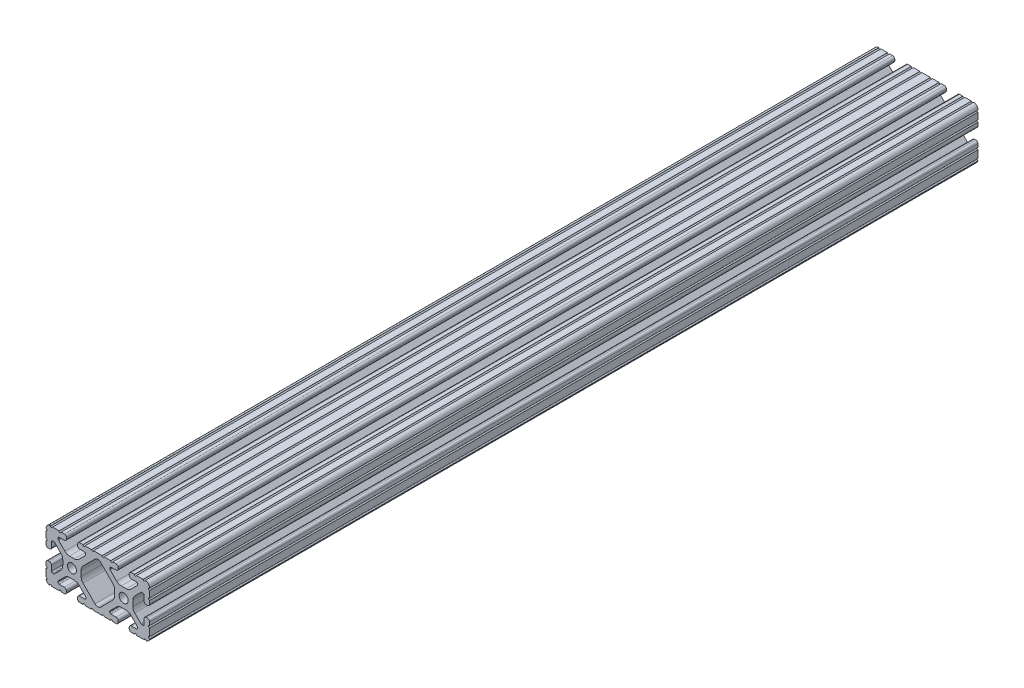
SolidWorks part; units mm, degrees
ref_plane "Front" through (0, 0, 0) normal (0, 0, 1) x (1, 0, 0)
ref_plane "Top" through (0, 0, 0) normal (0, 1, 0) x (1, 0, 0)
ref_plane "Right" through (0, 0, 0) normal (1, 0, 0) x (0, 0, -1)
sketch "Sketch1" plane through (0, 0, 0) normal (0, 0, 1) x (1, 0, 0)
  line L2 (30.3513, 26.5282) -> (39.1767, 35.3536)
  line L3 (40.5679, 38.7122) -> (40.5679, 42.8592)
  line L4 (39.1767, 46.2178) -> (30.3513, 55.0433)
  line L5 (26.1972, 55.0433) -> (17.3719, 46.2178)
  line L6 (15.9807, 42.8592) -> (15.9807, 38.7122)
  line L7 (17.3719, 35.3536) -> (26.1972, 26.5282)
  line L8 (37.19, 54.3201) -> (37.19, 54.8827)
  line L9 (38.079, 55.7717) -> (41.6855, 55.7717)
  line L10 (43.2603, 57.3465) -> (43.2603, 58.2825)
  line L11 (41.707, 59.8357) -> (39.2718, 59.8357)
  line L12 (37.7478, 59.8357) -> (32.9194, 59.8357)
  line L13 (31.3954, 59.8357) -> (25.1532, 59.8357)
  line L14 (23.6292, 59.8357) -> (18.8007, 59.8357)
  line L15 (17.2767, 59.8357) -> (14.8415, 59.8357)
  line L16 (13.2883, 58.2825) -> (13.2883, 57.3465)
  line L17 (14.8631, 55.7717) -> (18.4695, 55.7717)
  line L18 (19.3585, 54.8827) -> (19.3585, 54.3201)
  line L19 (19.0981, 53.6915) -> (14.4218, 49.0151)
  line L20 (11.0632, 47.6239) -> (7.3854, 47.6239)
  line L21 (4.0268, 49.0151) -> (-0.6496, 53.6915)
  line L22 (-0.91, 54.3201) -> (-0.91, 54.8827)
  line L23 (-0.021, 55.7717) -> (3.5855, 55.7717)
  line L24 (5.1603, 57.3465) -> (5.1603, 58.2663)
  line L25 (3.7154, 59.8357) -> (1.3285, 59.8357)
  line L26 (-0.1955, 59.8357) -> (-5.022, 59.8357)
  line L27 (-9.8257, 55.1609) -> (-9.8257, 50.3354)
  line L28 (-9.8257, 48.8114) -> (-9.8257, 46.4245)
  line L29 (-8.2509, 44.8497) -> (-7.3365, 44.8497)
  line L30 (-5.7617, 46.4245) -> (-5.7617, 50.1837)
  line L31 (-4.8727, 51.0727) -> (-4.1464, 51.0727)
  line L32 (-3.5178, 50.8123) -> (1.0767, 46.2178)
  line L33 (2.4679, 42.8592) -> (2.4679, 38.7122)
  line L34 (1.0767, 35.3536) -> (-3.5178, 30.7591)
  line L35 (-4.1464, 30.4987) -> (-4.8727, 30.4987)
  line L36 (-5.7617, 31.3877) -> (-5.7617, 35.1469)
  line L37 (-7.3365, 36.7217) -> (-8.2509, 36.7217)
  line L38 (-9.8257, 35.1469) -> (-9.8257, 32.76)
  line L39 (-9.8257, 31.236) -> (-9.8257, 25.7497)
  line L40 (-5.773, 21.7357) -> (-0.1955, 21.7357)
  line L41 (1.3285, 21.7357) -> (3.5855, 21.7357)
  line L42 (5.1603, 23.3105) -> (5.1603, 24.2249)
  line L43 (3.5855, 25.7997) -> (-0.1737, 25.7997)
  line L44 (-1.0627, 26.6887) -> (-1.0627, 27.0985)
  line L45 (-0.8023, 27.7272) -> (4.0268, 32.5563)
  line L46 (7.3854, 33.9475) -> (11.0632, 33.9475)
  line L47 (14.4218, 32.5563) -> (19.2509, 27.7272)
  line L48 (19.5113, 27.0985) -> (19.5113, 26.6887)
  line L49 (18.6223, 25.7997) -> (14.8631, 25.7997)
  line L50 (13.2883, 24.2249) -> (13.2883, 23.3105)
  line L51 (14.8631, 21.7357) -> (17.2767, 21.7357)
  line L52 (18.8007, 21.7357) -> (23.6292, 21.7357)
  line L53 (25.1532, 21.7357) -> (31.3954, 21.7357)
  line L54 (32.9194, 21.7357) -> (37.7478, 21.7357)
  line L55 (39.2718, 21.7357) -> (41.6855, 21.7357)
  line L56 (43.2603, 23.3105) -> (43.2603, 24.2249)
  line L57 (41.6855, 25.7997) -> (37.9263, 25.7997)
  line L58 (37.0373, 26.6887) -> (37.0373, 27.0985)
  line L59 (37.2977, 27.7272) -> (42.1268, 32.5563)
  line L60 (45.4854, 33.9475) -> (49.1632, 33.9475)
  line L61 (52.5218, 32.5563) -> (57.3509, 27.7272)
  line L62 (57.6113, 27.0985) -> (57.6113, 26.6887)
  line L63 (56.7223, 25.7997) -> (52.9631, 25.7997)
  line L64 (51.3883, 24.2249) -> (51.3883, 23.3105)
  line L65 (52.9631, 21.7357) -> (55.2201, 21.7357)
  line L66 (56.7441, 21.7357) -> (62.3216, 21.7357)
  line L67 (66.3743, 25.7497) -> (66.3743, 31.236)
  line L68 (66.3743, 32.76) -> (66.3743, 35.1469)
  line L69 (64.7995, 36.7217) -> (63.8851, 36.7217)
  line L70 (62.3103, 35.1469) -> (62.3103, 31.3877)
  line L71 (61.4213, 30.4987) -> (60.6949, 30.4987)
  line L72 (60.0663, 30.7591) -> (55.4719, 35.3536)
  line L73 (54.0807, 38.7122) -> (54.0807, 42.8592)
  line L74 (55.4719, 46.2178) -> (60.0663, 50.8123)
  line L75 (60.6949, 51.0727) -> (61.4213, 51.0727)
  line L76 (62.3103, 50.1837) -> (62.3103, 46.4245)
  line L77 (63.8851, 44.8497) -> (64.7995, 44.8497)
  line L78 (66.3743, 46.4245) -> (66.3743, 48.8114)
  line L79 (66.3743, 50.3354) -> (66.3743, 55.1609)
  line L80 (61.5705, 59.8357) -> (56.7441, 59.8357)
  line L81 (55.2201, 59.8357) -> (52.8332, 59.8357)
  line L82 (51.3883, 58.2663) -> (51.3883, 57.3465)
  line L83 (52.9631, 55.7717) -> (56.5695, 55.7717)
  line L84 (57.4585, 54.8827) -> (57.4585, 54.3201)
  line L85 (57.1981, 53.6915) -> (52.5218, 49.0151)
  line L86 (49.1632, 47.6239) -> (45.4854, 47.6239)
  line L87 (42.1268, 49.0151) -> (37.4504, 53.6915)
  arc A0 (39.1767, 35.3536) -> (40.5679, 38.7122) centre (35.8181, 38.7122) ccw
  arc A1 (30.3513, 55.0433) -> (28.2743, 55.8988) centre (28.2858, 52.9778) ccw
  arc A2 (28.2743, 55.8988) -> (26.1972, 55.0433) centre (28.2627, 52.9778) ccw
  arc A3 (17.3719, 46.2178) -> (15.9807, 42.8592) centre (20.7305, 42.8592) ccw
  arc A4 (15.9807, 38.7122) -> (17.3719, 35.3536) centre (20.7305, 38.7122) ccw
  arc A5 (26.1972, 26.5282) -> (28.2743, 25.6726) centre (28.2627, 28.5936) ccw
  arc A6 (28.2743, 25.6726) -> (30.3513, 26.5282) centre (28.2858, 28.5936) ccw
  circle A7 centre (47.3243, 40.7857) radius 3.3274
  circle A8 centre (9.2243, 40.7857) radius 3.3274
  arc A9 (40.5679, 42.8592) -> (39.1767, 46.2178) centre (35.8181, 42.8592) ccw
  arc A10 (38.079, 55.7717) -> (37.19, 54.8827) centre (38.079, 54.8827) ccw
  arc A11 (41.6855, 55.7717) -> (43.2603, 57.3465) centre (41.6855, 57.3465) ccw
  arc A12 (43.2603, 58.2825) -> (41.707, 59.8357) centre (41.707, 58.2825) ccw
  arc A13 (37.7478, 59.8357) -> (39.2718, 59.8357) centre (38.5098, 59.8357) ccw
  arc A14 (31.3954, 59.8357) -> (32.9194, 59.8357) centre (32.1574, 59.8357) ccw
  arc A15 (23.6292, 59.8357) -> (25.1532, 59.8357) centre (24.3912, 59.8357) ccw
  arc A16 (17.2767, 59.8357) -> (18.8007, 59.8357) centre (18.0387, 59.8357) ccw
  arc A17 (14.8415, 59.8357) -> (13.2883, 58.2825) centre (14.8415, 58.2825) ccw
  arc A18 (13.2883, 57.3465) -> (14.8631, 55.7717) centre (14.8631, 57.3465) ccw
  arc A19 (19.3585, 54.8827) -> (18.4695, 55.7717) centre (18.4695, 54.8827) ccw
  arc A20 (19.0981, 53.6915) -> (19.3585, 54.3201) centre (18.4695, 54.3201) ccw
  arc A21 (11.0632, 47.6239) -> (14.4218, 49.0151) centre (11.0632, 52.3737) ccw
  arc A22 (4.0268, 49.0151) -> (7.3854, 47.6239) centre (7.3854, 52.3737) ccw
  arc A23 (-0.91, 54.3201) -> (-0.6496, 53.6915) centre (-0.021, 54.3201) ccw
  arc A24 (-0.021, 55.7717) -> (-0.91, 54.8827) centre (-0.021, 54.8827) ccw
  arc A25 (3.5855, 55.7717) -> (5.1603, 57.3465) centre (3.5855, 57.3465) ccw
  arc A26 (5.1603, 58.2663) -> (3.7154, 59.8357) centre (3.5855, 58.2663) ccw
  arc A27 (-0.1955, 59.8357) -> (1.3285, 59.8357) centre (0.5665, 59.8357) ccw
  arc A28 (-6.5453, 59.8825) -> (-5.022, 59.8357) centre (-5.7836, 59.8591) ccw
  arc A29 (-6.5453, 59.8825) -> (-9.8633, 56.684) centre (-6.6287, 56.6488) ccw
  arc A30 (-9.8257, 55.1609) -> (-9.8633, 56.684) centre (-9.8257, 55.9229) ccw
  arc A31 (-9.8257, 48.8114) -> (-9.8257, 50.3354) centre (-9.8257, 49.5734) ccw
  arc A32 (-9.8257, 46.4245) -> (-8.2509, 44.8497) centre (-8.2509, 46.4245) ccw
  arc A33 (-7.3365, 44.8497) -> (-5.7617, 46.4245) centre (-7.3365, 46.4245) ccw
  arc A34 (-4.8727, 51.0727) -> (-5.7617, 50.1837) centre (-4.8727, 50.1837) ccw
  arc A35 (-3.5178, 50.8123) -> (-4.1464, 51.0727) centre (-4.1464, 50.1837) ccw
  arc A36 (2.4679, 42.8592) -> (1.0767, 46.2178) centre (-2.2819, 42.8592) ccw
  arc A37 (1.0767, 35.3536) -> (2.4679, 38.7122) centre (-2.2819, 38.7122) ccw
  arc A38 (-4.1464, 30.4987) -> (-3.5178, 30.7591) centre (-4.1464, 31.3877) ccw
  arc A39 (-5.7617, 31.3877) -> (-4.8727, 30.4987) centre (-4.8727, 31.3877) ccw
  arc A40 (-5.7617, 35.1469) -> (-7.3365, 36.7217) centre (-7.3365, 35.1469) ccw
  arc A41 (-8.2509, 36.7217) -> (-9.8257, 35.1469) centre (-8.2509, 35.1469) ccw
  arc A42 (-9.8257, 31.236) -> (-9.8257, 32.76) centre (-9.8257, 31.998) ccw
  arc A43 (-9.8257, 24.2257) -> (-9.8257, 25.7497) centre (-9.8257, 24.9877) ccw
  arc A44 (-9.8257, 24.2257) -> (-7.297, 21.7357) centre (-6.6712, 24.9002) ccw
  arc A45 (-5.773, 21.7357) -> (-7.297, 21.7357) centre (-6.535, 21.7357) ccw
  arc A46 (1.3285, 21.7357) -> (-0.1955, 21.7357) centre (0.5665, 21.7357) ccw
  arc A47 (3.5855, 21.7357) -> (5.1603, 23.3105) centre (3.5855, 23.3105) ccw
  arc A48 (5.1603, 24.2249) -> (3.5855, 25.7997) centre (3.5855, 24.2249) ccw
  arc A49 (-1.0627, 26.6887) -> (-0.1737, 25.7997) centre (-0.1737, 26.6887) ccw
  arc A50 (-0.8023, 27.7272) -> (-1.0627, 27.0985) centre (-0.1737, 27.0985) ccw
  arc A51 (7.3854, 33.9475) -> (4.0268, 32.5563) centre (7.3854, 29.1977) ccw
  arc A52 (14.4218, 32.5563) -> (11.0632, 33.9475) centre (11.0632, 29.1977) ccw
  arc A53 (19.5113, 27.0985) -> (19.2509, 27.7272) centre (18.6223, 27.0985) ccw
  arc A54 (18.6223, 25.7997) -> (19.5113, 26.6887) centre (18.6223, 26.6887) ccw
  arc A55 (14.8631, 25.7997) -> (13.2883, 24.2249) centre (14.8631, 24.2249) ccw
  arc A56 (13.2883, 23.3105) -> (14.8631, 21.7357) centre (14.8631, 23.3105) ccw
  arc A57 (18.8007, 21.7357) -> (17.2767, 21.7357) centre (18.0387, 21.7357) ccw
  arc A58 (25.1532, 21.7357) -> (23.6292, 21.7357) centre (24.3912, 21.7357) ccw
  arc A59 (32.9194, 21.7357) -> (31.3954, 21.7357) centre (32.1574, 21.7357) ccw
  arc A60 (39.2718, 21.7357) -> (37.7478, 21.7357) centre (38.5098, 21.7357) ccw
  arc A61 (41.6855, 21.7357) -> (43.2603, 23.3105) centre (41.6855, 23.3105) ccw
  arc A62 (43.2603, 24.2249) -> (41.6855, 25.7997) centre (41.6855, 24.2249) ccw
  arc A63 (37.0373, 26.6887) -> (37.9263, 25.7997) centre (37.9263, 26.6887) ccw
  arc A64 (37.2977, 27.7272) -> (37.0373, 27.0985) centre (37.9263, 27.0985) ccw
  arc A65 (45.4854, 33.9475) -> (42.1268, 32.5563) centre (45.4854, 29.1977) ccw
  arc A66 (52.5218, 32.5563) -> (49.1632, 33.9475) centre (49.1632, 29.1977) ccw
  arc A67 (57.6113, 27.0985) -> (57.3509, 27.7272) centre (56.7223, 27.0985) ccw
  arc A68 (56.7223, 25.7997) -> (57.6113, 26.6887) centre (56.7223, 26.6887) ccw
  arc A69 (52.9631, 25.7997) -> (51.3883, 24.2249) centre (52.9631, 24.2249) ccw
  arc A70 (51.3883, 23.3105) -> (52.9631, 21.7357) centre (52.9631, 23.3105) ccw
  arc A71 (56.7441, 21.7357) -> (55.2201, 21.7357) centre (55.9821, 21.7357) ccw
  arc A72 (63.8456, 21.7357) -> (62.3216, 21.7357) centre (63.0836, 21.7357) ccw
  arc A73 (63.8456, 21.7357) -> (66.3743, 24.2257) centre (63.2122, 24.9079) ccw
  arc A74 (66.3743, 25.7497) -> (66.3743, 24.2257) centre (66.3743, 24.9877) ccw
  arc A75 (66.3743, 32.76) -> (66.3743, 31.236) centre (66.3743, 31.998) ccw
  arc A76 (66.3743, 35.1469) -> (64.7995, 36.7217) centre (64.7995, 35.1469) ccw
  arc A77 (63.8851, 36.7217) -> (62.3103, 35.1469) centre (63.8851, 35.1469) ccw
  arc A78 (61.4213, 30.4987) -> (62.3103, 31.3877) centre (61.4213, 31.3877) ccw
  arc A79 (60.0663, 30.7591) -> (60.6949, 30.4987) centre (60.6949, 31.3877) ccw
  arc A80 (54.0807, 38.7122) -> (55.4719, 35.3536) centre (58.8305, 38.7122) ccw
  arc A81 (55.4719, 46.2178) -> (54.0807, 42.8592) centre (58.8305, 42.8592) ccw
  arc A82 (60.6949, 51.0727) -> (60.0663, 50.8123) centre (60.6949, 50.1837) ccw
  arc A83 (62.3103, 50.1837) -> (61.4213, 51.0727) centre (61.4213, 50.1837) ccw
  arc A84 (62.3103, 46.4245) -> (63.8851, 44.8497) centre (63.8851, 46.4245) ccw
  arc A85 (64.7995, 44.8497) -> (66.3743, 46.4245) centre (64.7995, 46.4245) ccw
  arc A86 (66.3743, 50.3354) -> (66.3743, 48.8114) centre (66.3743, 49.5734) ccw
  arc A87 (66.4119, 56.684) -> (66.3743, 55.1609) centre (66.3743, 55.9229) ccw
  arc A88 (66.4119, 56.684) -> (63.0938, 59.8825) centre (63.1773, 56.6488) ccw
  arc A89 (61.5705, 59.8357) -> (63.0938, 59.8825) centre (62.3322, 59.8591) ccw
  arc A90 (55.2201, 59.8357) -> (56.7441, 59.8357) centre (55.9821, 59.8357) ccw
  arc A91 (52.8332, 59.8357) -> (51.3883, 58.2663) centre (52.9631, 58.2663) ccw
  arc A92 (51.3883, 57.3465) -> (52.9631, 55.7717) centre (52.9631, 57.3465) ccw
  arc A93 (57.4585, 54.8827) -> (56.5695, 55.7717) centre (56.5695, 54.8827) ccw
  arc A94 (57.1981, 53.6915) -> (57.4585, 54.3201) centre (56.5695, 54.3201) ccw
  arc A95 (49.1632, 47.6239) -> (52.5218, 49.0151) centre (49.1632, 52.3737) ccw
  arc A96 (42.1268, 49.0151) -> (45.4854, 47.6239) centre (45.4854, 52.3737) ccw
  arc A97 (37.19, 54.3201) -> (37.4504, 53.6915) centre (38.079, 54.3201) ccw
extrude "Extrude1" add sketch "Sketch1" along normal blind 609.6
